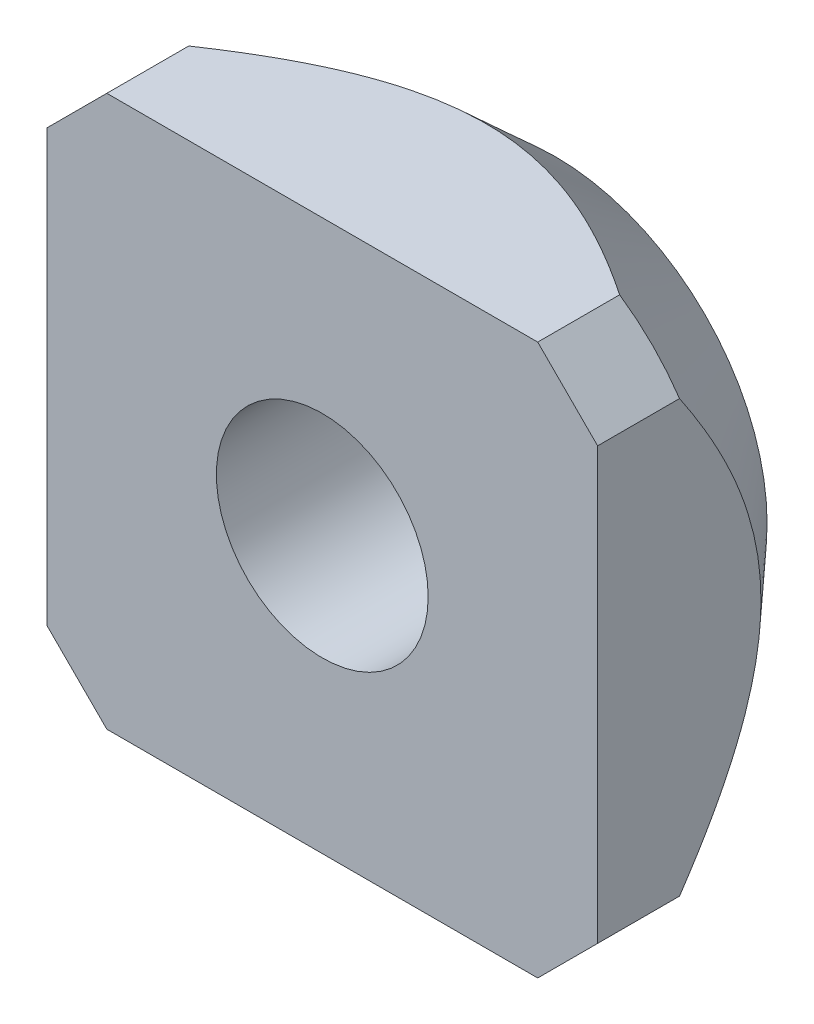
SolidWorks part; units mm, degrees
ref_plane "Front" through (0, 0, 0) normal (0, 0, 1) x (1, 0, 0)
ref_plane "Top" through (0, 0, 0) normal (0, 1, 0) x (1, 0, 0)
ref_plane "Right" through (0, 0, 0) normal (1, 0, 0) x (0, 0, -1)
imported_body "Imported1"
hole_wizard "M6x1.0 Tapped Hole1" positions "3DSketch1" profile "Sketch1" tap size "M6x1.0" standard "Ansi Metric"
sketch3d "3DSketch1"
  line L0 (-6.5, 5.0858, 0) -> (-6.5, -5.0858, 0) construction
  line L1 (5.0858, 6.5, 0) -> (-5.0858, 6.5, 0) construction
  point P0 (0, 0, 0)
  dimension "D1" = 6.5
  dimension "D2" = 6.5
sketch "Sketch1" plane through (0, 0, 0) normal (1, 0, 0) x (0, -1, 0)
  line L0 (0, 0) -> (0, 18.5022)
  line L1 (0, 18.5022) -> (2.5, 17)
  line L2 (2.5, 17) -> (2.5, 0)
  line L5 (2.5, 0) -> (0, 0)
  line L10 (0, 18.5022) -> (-2.5, 17) construction
  line L11 (0, -6.35) -> (0, 107.95) construction
  dimension "Tap Drill Dia." = 5
  dimension "Tap Drill Depth" = 17
  dimension "Drill Angle" = 118
